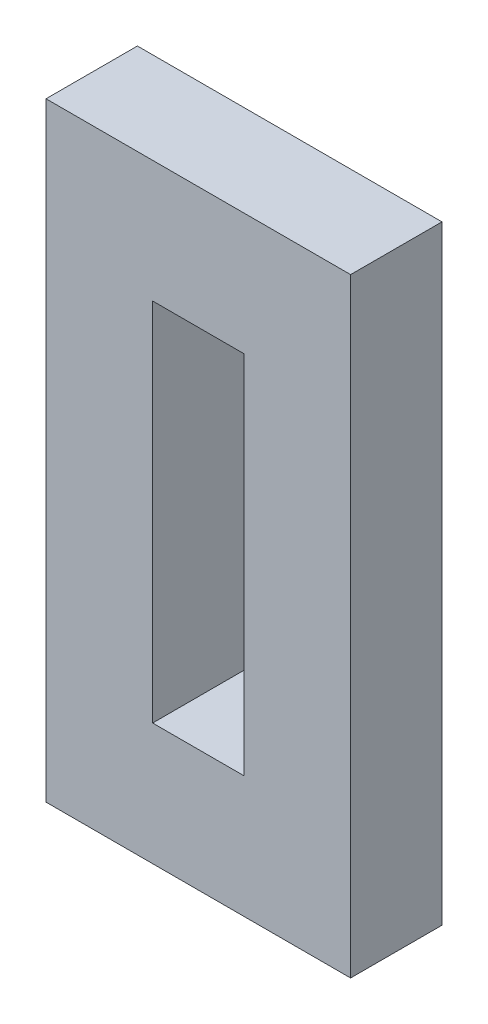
SolidWorks part; units mm, degrees
ref_plane "Plan1" through (0, 0, 0) normal (0, 0, 1) x (1, 0, 0)
ref_plane "Plan2" through (0, 0, 0) normal (0, 1, 0) x (1, 0, 0)
ref_plane "Plan3" through (0, 0, 0) normal (1, 0, 0) x (0, 0, -1)
sketch "Esquisse1" plane through (0, 0, 0) normal (0, 0, 1) x (1, 0, 0)
  line L0 (6.5, 10) -> (10, 10) construction
  line L1 (0, 0) -> (10, 0)
  line L2 (0, 0) -> (0, 20)
  line L3 (0, 20) -> (10, 20)
  line L4 (10, 0) -> (10, 20)
  line L5 (3.5, 16) -> (6.5, 16)
  line L6 (3.5, 16) -> (3.5, 4)
  line L7 (3.5, 4) -> (6.5, 4)
  line L8 (6.5, 16) -> (6.5, 4)
  line L9 (3.5, 10) -> (0, 10) construction
  dimension "D1" = 10
  dimension "D2" = 20
  dimension "D3" = 3
  dimension "D4" = 12
extrude "Base-Extrusion" add sketch "Esquisse1" along normal blind 3
